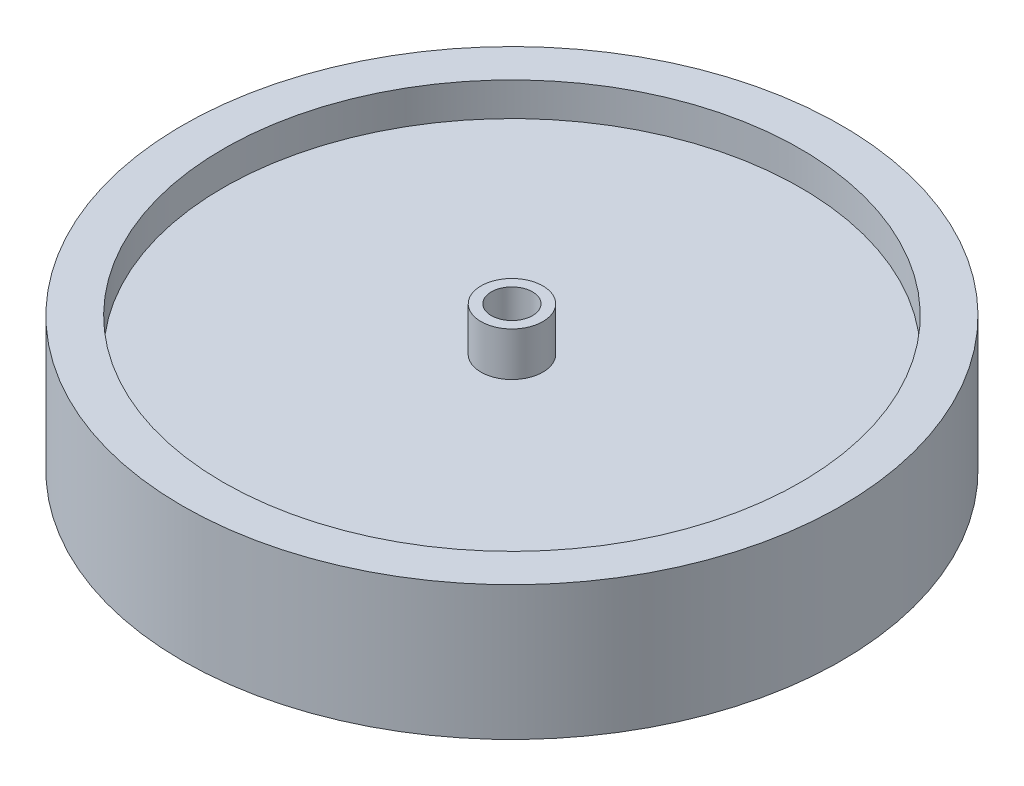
SolidWorks part; units mm, degrees
ref_plane "Front" through (0, 0, 0) normal (0, 0, 1) x (1, 0, 0)
ref_plane "Top" through (0, 0, 0) normal (0, 1, 0) x (1, 0, 0)
ref_plane "Right" through (0, 0, 0) normal (1, 0, 0) x (0, 0, -1)
sketch "Sketch3" plane through (0, 0, 0) normal (0, 0, 1) x (1, 0, 0)
  line L0 (0, 28.7362) -> (0, -28.7362) construction
  line L1 (0, -4.9237) -> (4.7625, -4.9237)
  line L2 (4.7625, -4.9237) -> (4.7625, -6.5112)
  line L3 (4.7625, -6.5112) -> (50.7365, -6.5112)
  line L4 (50.7365, -27.1487) -> (4.7625, -27.1487)
  line L5 (4.7625, -27.1487) -> (4.7625, -28.7362)
  line L6 (4.7625, -28.7362) -> (0, -28.7362)
  line L7 (50.7365, -6.5112) -> (50.7365, -27.1487)
  line L8 (0, -28.7362) -> (0, -4.9237)
  dimension "D1" = 20.6375
  dimension "D2" = 1.5875
  dimension "D3" = 1.5875
  dimension "D4" = 4.7625
  dimension "D5" = 4.7625
  dimension "D6" = 45.974
revolve "Revolve1" add sketch "Sketch3" angle 360 about L0
sketch "Sketch4" plane through (0, -6.5112, 0) normal (0, 1, 0) x (-1, 0, 0)
  circle A0 centre (0, 0) radius 4.7625
  circle A1 centre (0, 0) radius 44.45
  dimension "D1" = 88.9
  dimension "D2" = 9.525
extrude "Cut-Extrude1" cut sketch "Sketch4" against normal blind 5.1562
sketch "Sketch5" plane through (0, -27.1487, 0) normal (0, -1, 0) x (1, 0, 0)
  circle A0 centre (0, 0) radius 4.7625
  circle A1 centre (0, 0) radius 44.45
  dimension "D1" = 88.9
  dimension "D2" = 9.525
extrude "Cut-Extrude2" cut sketch "Sketch5" against normal blind 5.1562
sketch "Sketch6" plane through (0, -28.7362, 0) normal (0, -1, 0) x (1, 0, 0)
  circle A0 centre (0, 0) radius 3.175
  dimension "D1" = 6.35
extrude "Bore" cut sketch "Sketch6" against normal through all
